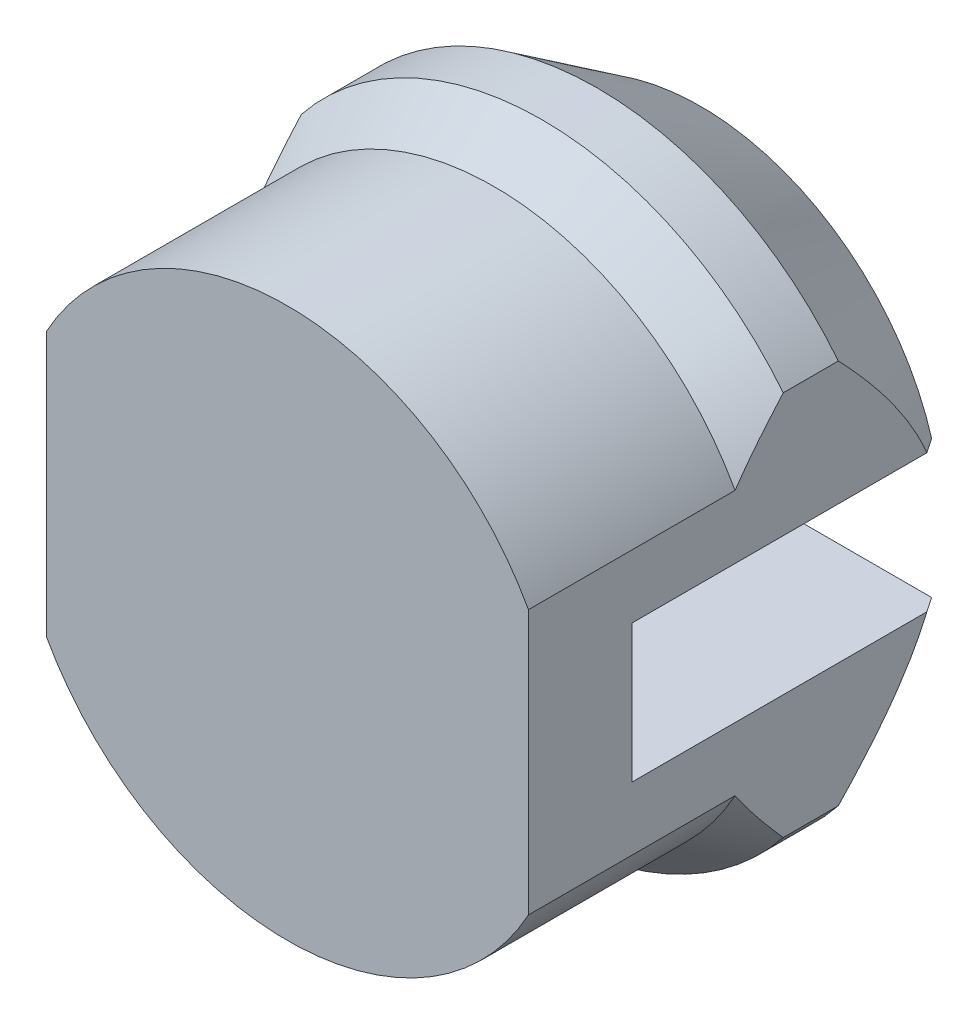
SolidWorks part; units mm, degrees
ref_plane "Front Plane" through (0, 0, 0) normal (0, 0, 1) x (1, 0, 0)
ref_plane "Top Plane" through (0, 0, 0) normal (0, 1, 0) x (1, 0, 0)
ref_plane "Right Plane" through (0, 0, 0) normal (1, 0, 0) x (0, 0, -1)
sketch "Sketch7" plane through (0, 0, 0) normal (0, 1, 0) x (1, 0, 0)
  line L0 (3.5, 6) -> (1.589, 6)
  line L1 (1.589, 6) -> (1.589, 1.5)
  line L2 (1.589, 1.5) -> (0, 1.5)
  line L3 (0, 1.5) -> (0, 0)
  line L4 (0, 0) -> (3.9917, 0)
  line L5 (3.9917, 0) -> (3.9917, 3)
  line L6 (3.9917, 3) -> (4.4801, 3.7)
  line L7 (4.4801, 3.7) -> (4.4801, 4.5)
  line L8 (4.4801, 4.5) -> (3.5, 6)
  dimension "D1" = 3.9917
  dimension "D2" = 1.911
  dimension "D3" = 4.5
  dimension "D4" = 3
  dimension "D5" = 0.8
  dimension "D6" = 1.5
  dimension "D7" = 0.7
  dimension "D8" = 4.4801
  dimension "D9" = 3.5
revolve "Revolve2" add sketch "Sketch7" angle 360 about L3
sketch "Sketch9" plane through (0, 0, -6) normal (0, 0, -1) x (-1, 0, 0)
  line L1 (4.4801, -1) -> (-4.4801, -1)
  line L2 (4.4801, -1) -> (4.4801, 1)
  line L3 (4.4801, 1) -> (-4.4801, 1)
  line L4 (-4.4801, -1) -> (-4.4801, 1)
  line L5 (4.4801, -1) -> (-4.4801, 1) construction
  line L6 (4.4801, 1) -> (-4.4801, -1) construction
  circle A0 centre (0, 0) radius 4.4801 construction
  point P0 (0, 0)
  dimension "D1" = 2
extrude "Cut-Extrude2" cut sketch "Sketch9" along direction (0, 0, 1) on the side against the normal up to surface (4.5 mm away)
sketch "Sketch10" plane through (0, 0, -6) normal (0, 0, -1) x (-1, 0, 0)
  line L0 (-3.5, 2.7966) -> (-4.4801, 2.7966)
  line L2 (3.5, -2.7966) -> (3.5, 2.7966)
  line L3 (-3.5, -2.7966) -> (-4.4801, -2.7966)
  line L4 (-3.5, -2.7966) -> (-3.5, 2.7966)
  line L5 (3.5, -2.7966) -> (-3.5, 2.7966) construction
  line L6 (3.5, 2.7966) -> (-3.5, -2.7966) construction
  line L7 (4.4801, -2.7966) -> (3.5, -2.7966)
  line L8 (4.4801, -2.7966) -> (4.4801, 2.7966)
  line L9 (4.4801, 2.7966) -> (3.5, 2.7966)
  line L10 (-4.4801, -2.7966) -> (-4.4801, 2.7966)
  arc A0 (4.367, 1) -> (-4.367, 1) centre (0, 0) ccw construction
  point P0 (0, 0)
  point P9 (0, 0)
  dimension "D1" = 7
extrude "Cut-Extrude4" cut sketch "Sketch10" against normal through all
